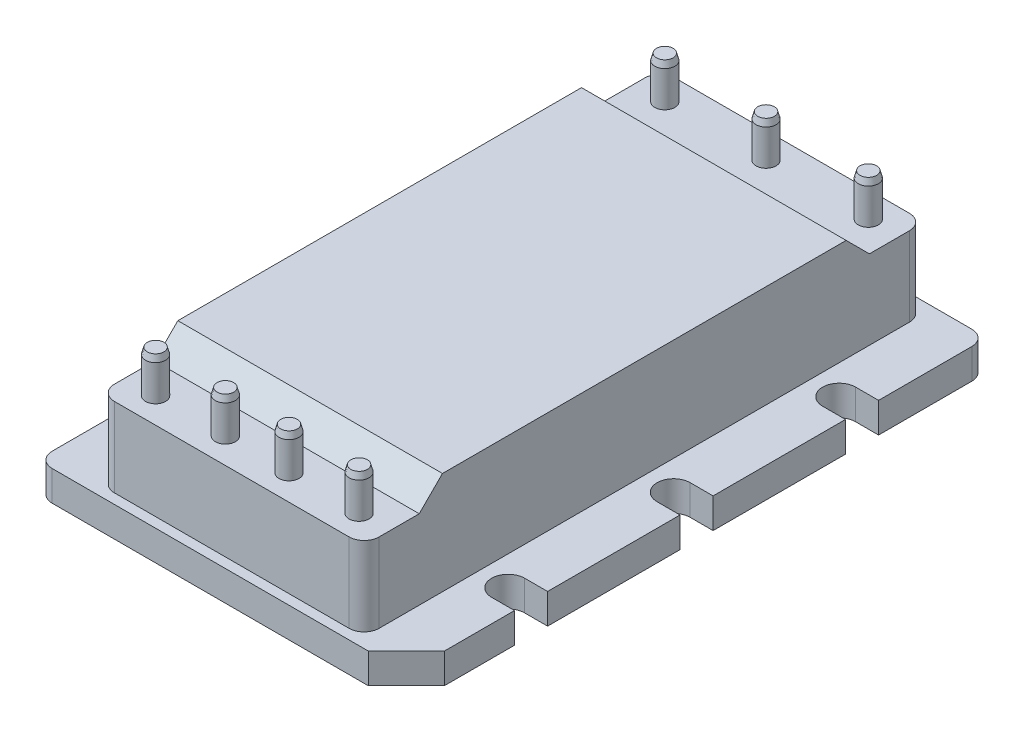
SolidWorks part; units mm, degrees
ref_plane "Front Plane" through (0, 0, 0) normal (0, 0, 1) x (1, 0, 0)
ref_plane "Top Plane" through (0, 0, 0) normal (0, 1, 0) x (1, 0, 0)
ref_plane "Right Plane" through (0, 0, 0) normal (1, 0, 0) x (0, 0, -1)
sketch "Sketch1" plane through (0, 0, 0) normal (0, 1, 0) x (1, 0, 0)
  line L1 (0, 0) -> (36.83, 0)
  line L2 (0, 0) -> (0, 57.91)
  line L3 (0, 57.91) -> (36.83, 57.91)
  line L4 (36.83, 0) -> (36.83, 57.91)
  dimension "D1" = 57.91
  dimension "D2" = 36.83
extrude "Extrude1" add sketch "Sketch1" along normal blind 3
chamfer "Chamfer1" distance 3.8 angle 45 1 edges at (36.83, 1.5, 0)
fillet "Fillet1" radius 1.5 3 edges at (0, 1.5, 0) (36.83, 1.5, -57.91) (0, 1.5, -57.91)
sketch "Sketch2" plane through (0, 3, 0) normal (0, 1, 0) x (-1, 0, 0)
  line L0 (-35.33, -57.91) -> (-1.5, -57.91) construction
  line L1 (-6.715, -56.91) -> (-30.115, -56.91)
  line L2 (-5.215, -55.41) -> (-5.215, -2.5)
  line L3 (-6.715, -1) -> (-30.115, -1)
  line L4 (-31.615, -55.41) -> (-31.615, -2.5)
  line L5 (-1.5, 0) -> (-33.03, 0) construction
  line L6 (-36.83, -3.8) -> (-36.83, -56.41) construction
  line L7 (0, -56.41) -> (0, -1.5) construction
  arc A0 (-6.715, -56.91) -> (-5.215, -55.41) centre (-6.715, -55.41) ccw
  arc A1 (-30.115, -56.91) -> (-31.615, -55.41) centre (-30.115, -55.41) cw
  arc A2 (-30.115, -1) -> (-31.615, -2.5) centre (-30.115, -2.5) ccw
  arc A3 (-5.215, -2.5) -> (-6.715, -1) centre (-6.715, -2.5) ccw
  point P14 (-5.215, -56.91)
  point P17 (-31.615, -56.91)
  dimension "D6" = 1.5
  dimension "D1" = 26.4
  dimension "D2" = 1
  dimension "D3" = 1
  dimension "D4" = 5.215
  dimension "D5" = 5.215
extrude "Extrude2" add sketch "Sketch2" along normal blind 10.22
sketch "Sketch3" plane through (0, 3, 0) normal (0, 1, 0) x (-1, 0, 0)
  line L0 (-35.33, -57.91) -> (-1.5, -57.91) construction
  line L1 (0, -56.41) -> (0, -1.5) construction
  line L2 (-36.83, -3.8) -> (-36.83, -56.41) construction
  line L4 (-2.285, -47.11) -> (0, -47.11)
  line L5 (-2.285, -47.11) -> (-2.285, -43.81)
  line L6 (-2.285, -43.81) -> (0, -43.81)
  line L7 (0, -47.11) -> (0, -43.81)
  line L8 (-2.285, -30.6) -> (0, -30.6)
  line L9 (-2.285, -30.6) -> (-2.285, -27.3)
  line L10 (-2.285, -27.3) -> (0, -27.3)
  line L11 (0, -30.6) -> (0, -27.3)
  line L12 (-2.285, -14.09) -> (0, -14.09)
  line L13 (-2.285, -14.09) -> (-2.285, -10.79)
  line L14 (-2.285, -10.79) -> (0, -10.79)
  line L15 (0, -14.09) -> (0, -10.79)
  line L16 (-34.545, -14.09) -> (-36.83, -14.09)
  line L17 (-34.545, -14.09) -> (-34.545, -10.79)
  line L18 (-34.545, -10.79) -> (-36.83, -10.79)
  line L19 (-36.83, -14.09) -> (-36.83, -10.79)
  line L20 (-34.545, -27.3) -> (-36.83, -27.3)
  line L21 (-34.545, -27.3) -> (-34.545, -30.6)
  line L22 (-34.545, -30.6) -> (-36.83, -30.6)
  line L23 (-36.83, -27.3) -> (-36.83, -30.6)
  line L24 (-34.545, -43.81) -> (-36.83, -43.81)
  line L26 (-34.545, -47.11) -> (-36.83, -47.11)
  line L27 (-36.83, -43.81) -> (-36.83, -47.11)
  circle A0 centre (-2.285, -45.46) radius 1.65
  circle A1 centre (-2.285, -28.95) radius 1.65
  circle A2 centre (-2.285, -12.44) radius 1.65
  circle A3 centre (-34.545, -12.44) radius 1.65
  circle A4 centre (-34.545, -28.95) radius 1.65
  circle A5 centre (-34.545, -45.46) radius 1.65
  dimension "D1" = 16.51
  dimension "D2" = 16.51
  dimension "D3" = 32.26
  dimension "D4" = 12.45
  dimension "D5" = 2.285
  dimension "D6" = 2.285
extrude "Cut-Extrude1" cut sketch "Sketch3" against normal blind 12.7
sketch "Sketch4" plane through (5.215, 0, 0) normal (-1, 0, 0) x (0, 0, 1)
  line L1 (-56.91, 13.22) -> (-51.41, 13.22)
  line L2 (-56.91, 13.22) -> (-56.91, 10.9)
  line L3 (-56.91, 10.9) -> (-51.41, 10.9)
  line L4 (-51.41, 13.22) -> (-51.41, 10.9)
  line L5 (-1, 13.22) -> (-6.5, 13.22)
  line L6 (-1, 13.22) -> (-1, 10.9)
  line L7 (-1, 10.9) -> (-6.5, 10.9)
  line L8 (-6.5, 13.22) -> (-6.5, 10.9)
  dimension "D1" = 5.5
  dimension "D2" = 5.5
  dimension "D3" = 2.32
  dimension "D4" = 2.32
extrude "Cut-Extrude2" cut sketch "Sketch4" against normal through all
chamfer "Chamfer2" distance 2.32 angle 45 2 edges at (18.415, 13.22, -51.41) (18.415, 13.22, -6.5)
sketch "Sketch6" plane through (0, 10.9, 0) normal (0, 1, 0) x (-1, 0, 0)
  line L0 (-31.615, -6.5) -> (-31.615, -2.5) construction
  line L1 (-5.215, -6.5) -> (-5.215, -2.5) construction
  line L2 (-18.415, -1) -> (-18.415, -13.0517) construction
  line L3 (-6.715, -1) -> (-30.115, -1) construction
  circle A0 centre (-28.565, -3.55) radius 1
  circle A1 centre (-21.575, -3.55) radius 1
  circle A2 centre (-15.225, -3.55) radius 1
  circle A3 centre (-8.265, -3.55) radius 1
  circle A4 centre (-28.565, -54.35) radius 1
  circle A5 centre (-18.365, -54.35) radius 1
  circle A6 centre (-8.265, -54.35) radius 1
  arc A7 (-34.545, -14.09) -> (-34.545, -10.79) centre (-34.545, -12.44) ccw construction
  dimension "D1" = 6.99
  dimension "D8" = 8.89
  dimension "D2" = 13.34
  dimension "D3" = 20.3
  dimension "D4" = 10.2
  dimension "D5" = 3.05
  dimension "D6" = 3.05
  dimension "D7" = 50.8
  dimension "D9" = 3.19
  dimension "D10" = 3.16
  dimension "D11" = 10.15
  dimension "D12" = 10.15
extrude "Extrude3" add sketch "Sketch6" along normal blind 4.2
chamfer "Chamfer3" distance 0.64 angle 15 7 edges at (28.565, 15.1, -53.35) (18.365, 15.1, -53.35) (8.265, 15.1, -53.35) (8.265, 15.1, -2.55) (15.225, 15.1, -2.55) (21.575, 15.1, -2.55) (28.565, 15.1, -2.55)
